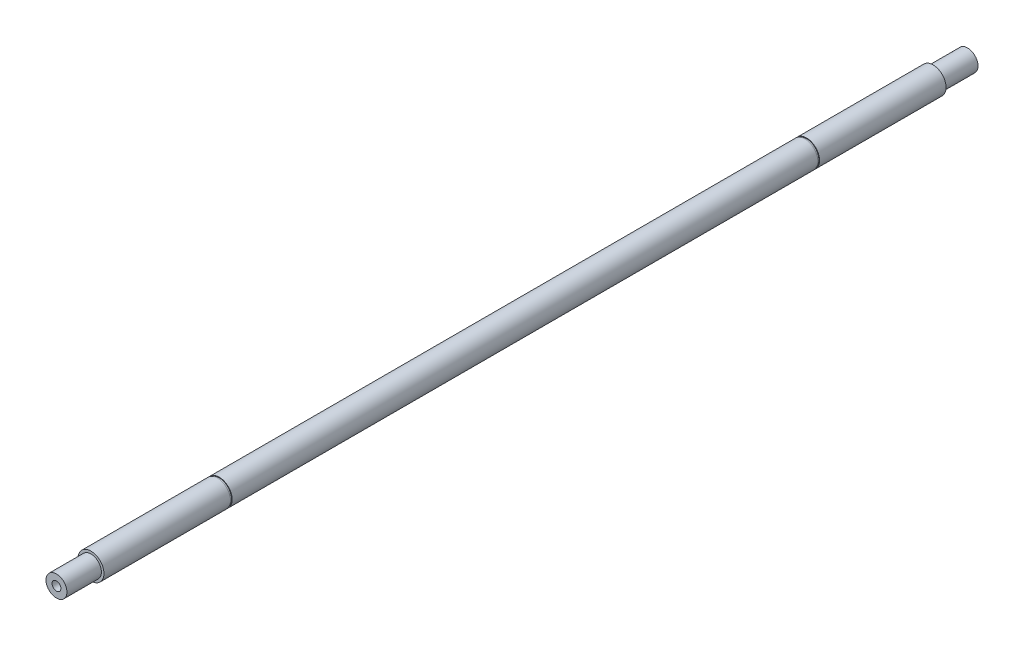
SolidWorks part; units mm, degrees
ref_plane "Plan de face" through (0, 0, 0) normal (0, 0, 1) x (1, 0, 0)
ref_plane "Plan de dessus" through (0, 0, 0) normal (0, 1, 0) x (1, 0, 0)
ref_plane "Plan de droite" through (0, 0, 0) normal (1, 0, 0) x (0, 0, -1)
sketch "Esquisse1" plane through (0, 0, 0) normal (0, 0, 1) x (1, 0, 0)
  circle A0 centre (0, 0) radius 10
  dimension "D1" = 20
extrude "Extrusion1" add sketch "Esquisse1" along normal mid plane 700
sketch "Esquisse2" plane through (0, 0, 350) normal (0, 0, 1) x (1, 0, 0)
  circle A0 centre (0, 0) radius 8.05
  dimension "D1" = 16.1
extrude "Enlèv. mat.-Extru.1" cut sketch "Esquisse2" against normal blind 26.5 flip side to cut
sketch "Esquisse3" plane through (0, 0, -350) normal (0, 0, -1) x (-1, 0, 0)
  circle A0 centre (0, 0) radius 8.05
  dimension "D1" = 16.1
extrude "Enlèv. mat.-Extru.2" cut sketch "Esquisse3" against normal blind 26.5 flip side to cut
ref_plane "Plan1" through (0, 0, 350) normal (-1, 0, 0) x (0, 1, 0)
sketch "Esquisse5" plane through (0, 0, 350) normal (-1, 0, 0) x (0, 1, 0)
  line L0 (9.5, 123.7) -> (12, 123.7)
  line L1 (12, 123.7) -> (12, 125)
  line L2 (12, 125) -> (9.5, 125)
  line L3 (9.5, 125) -> (9.5, 123.7)
  line L4 (0, -50) -> (0, 50) construction
  line L8 (-8.05, 0) -> (8.05, 0) construction
  dimension "D1" = 125
revolve "Gorge pour DIN 471 - 20 x 1.2, Circlips extérieur - normal1" cut sketch "Esquisse5"
ref_plane "Plan2" through (0, 0, 350) normal (-1, 0, 0) x (0, 1, 0)
sketch "Esquisse7" plane through (0, 0, 350) normal (-1, 0, 0) x (0, 1, 0)
  line L0 (9.5, 575) -> (12, 575)
  line L1 (12, 575) -> (12, 576.3)
  line L2 (12, 576.3) -> (9.5, 576.3)
  line L3 (9.5, 576.3) -> (9.5, 575)
  line L4 (0, -50) -> (0, 50) construction
  line L6 (12, 125) -> (9.5, 125) construction
  dimension "D1" = 450
revolve "Gorge pour DIN 471 - 20 x 1.2, Circlips extérieur - normal2" cut sketch "Esquisse7" angle 360 about L4
hole_wizard "Trou taraudé M8x1.251" positions "Esquisse9" profile "Esquisse10" tap size "M8x1.25" standard "ISO"
sketch "Esquisse9" plane through (0, 0, 350) normal (0, 0, 1) x (1, 0, 0)
  circle A0 centre (0, 0) radius 8.05 construction
  point P0 (0, 0)
sketch "Esquisse10" plane through (0, 0, 350) normal (1, 0, 0) x (0, -1, 0)
  line L0 (0, 0) -> (0, 22.0429)
  line L1 (0, 22.0429) -> (3.4, 20)
  line L2 (3.4, 20) -> (3.4, 0)
  line L5 (3.4, 0) -> (0, 0)
  line L10 (0, 22.0429) -> (-3.4, 20) construction
  line L11 (0, -6.35) -> (0, 107.95) construction
  dimension "Diamètre du trou pour taraudage" = 6.8
  dimension "Profondeur du trou pour taraudage" = 20
  dimension "Angle de pointe" = 118
hole_wizard "Trou taraudé M8x1.252" positions "Esquisse12" profile "Esquisse11" tap size "M8x1.25" standard "ISO"
sketch "Esquisse12" plane through (0, 0, -350) normal (0, 0, -1) x (-1, 0, 0)
  circle A0 centre (0, 0) radius 8.05 construction
  point P0 (0, 0)
sketch "Esquisse11" plane through (0, 0, -350) normal (1, 0, 0) x (0, 1, 0)
  line L0 (0, 0) -> (0, 22.0429)
  line L1 (0, 22.0429) -> (3.4, 20)
  line L2 (3.4, 20) -> (3.4, 0)
  line L5 (3.4, 0) -> (0, 0)
  line L10 (0, 22.0429) -> (-3.4, 20) construction
  line L11 (0, -6.35) -> (0, 107.95) construction
  dimension "Diamètre du trou pour taraudage" = 6.8
  dimension "Profondeur du trou pour taraudage" = 20
  dimension "Angle de pointe" = 118
